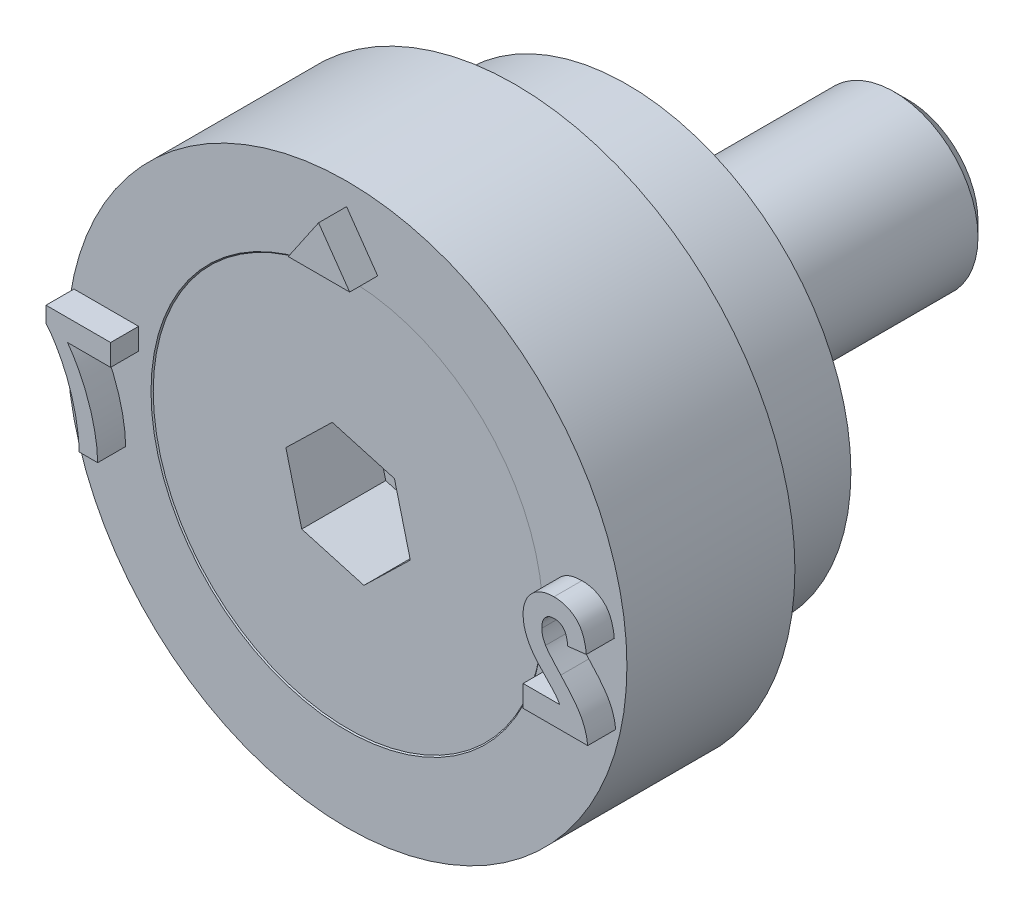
SolidWorks part; units mm, degrees
other "<M3 X .5 FHCS>-<Imported1>"
ref_plane "Front Plane" through (0, 0, 0) normal (0, 0, 1) x (1, 0, 0)
ref_plane "Top Plane" through (0, 0, 0) normal (0, 1, 0) x (1, 0, 0)
ref_plane "Right Plane" through (0, 0, 0) normal (1, 0, 0) x (0, 0, -1)
imported_body "Imported1"
other "DeleteFace1"
sketch "Sketch1" plane through (0, 0, 0) normal (0, 0, 1) x (1, 0, 0)
  line L0 (-0.0071, 4.6037) -> (-0.5487, 3.81)
  line L1 (-0.5487, 3.81) -> (0.5487, 3.81)
  line L2 (0.5487, 3.81) -> (-0.0071, 4.6037)
  text T0 "2             7" font "Arial" height 2
  dimension "D1" = 1.0795
  dimension "D2" = 4.9022
extrude "Boss-Extrude1" add sketch "Sketch1" along normal blind 0.5
inserted part "M3 X .5 FHCS"
move or copy body "Body-Move/Copy2" placed by mates yes
